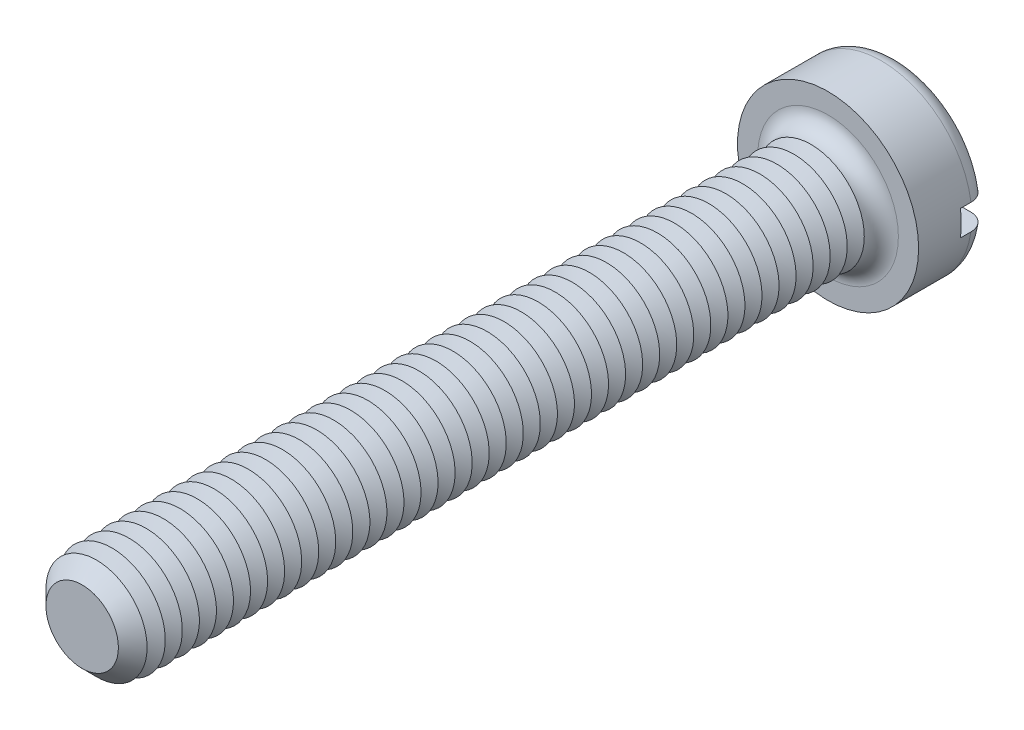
SolidWorks part; units mm, degrees
ref_plane "Front Plane" through (0, 0, 0) normal (0, 0, 1) x (1, 0, 0)
ref_plane "Top Plane" through (0, 0, 0) normal (0, 1, 0) x (1, 0, 0)
ref_plane "Right Plane" through (0, 0, 0) normal (1, 0, 0) x (0, 0, -1)
sketch "Sketch3" plane through (0, 0, 0) normal (0, 0, 1) x (1, 0, 0)
  circle A0 centre (0, 0) radius 4.25
  dimension "D1" = 8.5
extrude "Boss-Extrude2" add sketch "Sketch3" against normal blind 3.3
sketch "Sketch4" plane through (0, 0, 0) normal (0, 0, 1) x (1, 0, 0)
  circle A0 centre (0, 0) radius 2.5
  dimension "D1" = 5
extrude "Boss-Extrude3" add sketch "Sketch4" along normal blind 35
fillet "Fillet1" radius 0.8 2 edges at (4.25, 0, -3.3) (2.5, 0, 0)
chamfer "Chamfer1" distance 0.8 angle 45 1 edges at (2.5, 0, 35)
sketch "Sketch5" plane through (0, 0, 0) normal (1, 0, 0) x (0, 0, -1)
  line L0 (1.6944, 0) -> (-7.6738, 0) construction
sketch "Sketch6" plane through (0, 0, 0) normal (1, 0, 0) x (0, 0, -1)
  line L0 (-0.8, 2.5) -> (-1.2, 1.8072)
  line L1 (-1.2, 1.8072) -> (-1.6, 2.5)
  line L2 (-0.8, 2.5) -> (-34.2, 2.5) construction
  line L3 (-1.6, 2.5) -> (-0.8, 2.5)
  dimension "D1" = 0.8
revolve "Cut-Revolve1" cut sketch "Sketch6" angle 360 about L0
pattern_linear "LPattern1" count 42 spacing 0.8 along (0, 0, 1) of "Cut-Revolve1"
sketch "Sketch8" plane through (0, 0, -3.3) normal (0, 0, -1) x (-1, 0, 0)
  line L1 (4.25, -0.6) -> (-4.25, -0.6)
  line L2 (4.25, -0.6) -> (4.25, 0.6)
  line L3 (4.25, 0.6) -> (-4.25, 0.6)
  line L4 (-4.25, -0.6) -> (-4.25, 0.6)
  line L5 (4.25, -0.6) -> (-4.25, 0.6) construction
  line L6 (4.25, 0.6) -> (-4.25, -0.6) construction
  point P0 (0, 0)
  dimension "D1" = 8.5
  dimension "D2" = 1.2
extrude "Cut-Extrude1" cut sketch "Sketch8" against normal blind 1.3
